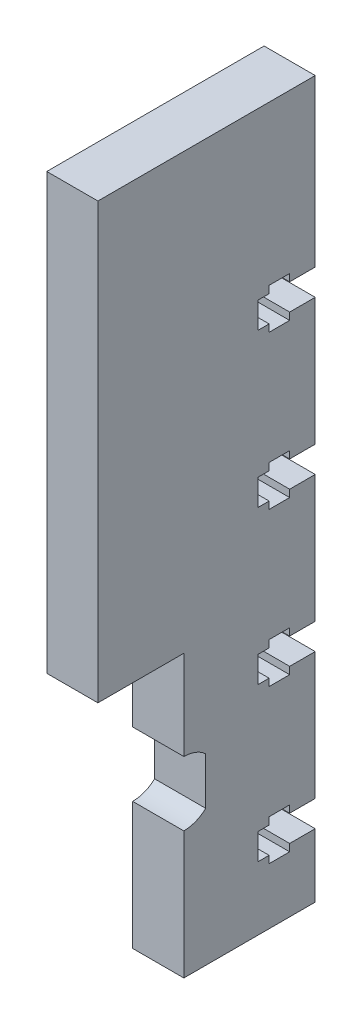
SolidWorks part; units mm, degrees
ref_plane "Front Plane" through (0, 0, 0) normal (0, 0, 1) x (1, 0, 0)
ref_plane "Top Plane" through (0, 0, 0) normal (0, 1, 0) x (1, 0, 0)
ref_plane "Right Plane" through (0, 0, 0) normal (1, 0, 0) x (0, 0, -1)
sketch "Sketch1" plane through (0, 0, 0) normal (0, 0, 1) x (1, 0, 0)
  line L0 (0, 0) -> (-42.672, 0) construction
  line L1 (-45.71, 0) -> (-33.01, 0)
  line L2 (-45.71, 0) -> (-45.71, 177.8)
  line L3 (-45.71, 177.8) -> (-33.01, 177.8)
  line L4 (-33.01, 0) -> (-33.01, 177.8)
  line L5 (-45.71, 45.5047) -> (-45.71, 33.7733) construction
  dimension "D1" = 12.7
  dimension "D2" = 177.8
extrude "Boss-Extrude1" add sketch "Sketch1" along normal blind 53.975
sketch "Sketch4" plane through (-33.01, 0, 0) normal (1, 0, 0) x (0, 0, -1)
  line L0 (-53.975, 69.85) -> (-32.6354, 69.85)
  line L1 (-53.975, 0) -> (-53.975, 177.8) construction
  line L2 (-32.6354, 69.85) -> (-53.975, 69.85) construction
  line L3 (-32.6354, 69.85) -> (-32.6354, 47.639)
  line L4 (-32.6354, 31.639) -> (-32.6354, 0)
  line L5 (-53.975, 0) -> (0, 0) construction
  line L6 (-32.6354, 0) -> (-53.975, 0)
  line L7 (-53.975, 0) -> (-53.975, 69.85)
  line L8 (-27.1954, 45.5047) -> (-27.1954, 33.7733)
  arc A0 (-27.1954, 45.5047) -> (-32.6354, 47.639) centre (-32.6354, 39.639) ccw
  arc A1 (-27.1954, 33.7733) -> (-32.6354, 31.639) centre (-32.6354, 39.639) cw
extrude "Cut-Extrude1" cut sketch "Sketch4" against normal through all
sketch "Sketch6" plane through (-33.01, 0, 0) normal (1, 0, 0) x (0, 0, -1)
  line L0 (-46.4072, 170.6201) -> (-48.8841, 162.9971)
  line L1 (0, 136.6) -> (-6.35, 136.6)
  line L2 (-6.35, 136.6) -> (-6.35, 138.4)
  line L3 (-6.35, 138.4) -> (-11.45, 138.4)
  line L4 (-11.45, 138.4) -> (-11.45, 136.6)
  line L5 (-11.45, 136.6) -> (-14.224, 136.6)
  line L6 (-14.224, 136.6) -> (-14.224, 130.1)
  line L7 (0, 136.6) -> (0, 130.1) construction
  line L8 (0, 133.35) -> (-39.8122, 133.35) construction
  line L9 (-11.45, 130.1) -> (-14.224, 130.1)
  line L10 (-11.45, 128.3) -> (-11.45, 130.1)
  line L11 (-6.35, 128.3) -> (-11.45, 128.3)
  line L12 (0, 130.1) -> (-6.35, 130.1)
  line L13 (-6.35, 130.1) -> (-6.35, 128.3)
  line L14 (0, 136.6) -> (0, 130.1)
  line L17 (0, 0) -> (0, 177.8) construction
  line L18 (0, 130.1) -> (6.35, 130.1) construction
  line L19 (-14.224, 98.5) -> (-14.224, 92)
  line L20 (-11.45, 90.2) -> (-11.45, 92)
  line L21 (-11.45, 92) -> (-14.224, 92)
  line L22 (-6.35, 90.2) -> (-11.45, 90.2)
  line L23 (-6.35, 92) -> (-6.35, 90.2)
  line L24 (0, 92) -> (-6.35, 92)
  line L25 (0, 98.5) -> (0, 92)
  line L26 (0, 98.5) -> (-6.35, 98.5)
  line L27 (-6.35, 98.5) -> (-6.35, 100.3)
  line L28 (-6.35, 100.3) -> (-11.45, 100.3)
  line L29 (-11.45, 100.3) -> (-11.45, 98.5)
  line L30 (-11.45, 98.5) -> (-14.224, 98.5)
  line L31 (-14.224, 60.4) -> (-14.224, 53.9)
  line L32 (-11.45, 52.1) -> (-11.45, 53.9)
  line L33 (-11.45, 53.9) -> (-14.224, 53.9)
  line L34 (-6.35, 52.1) -> (-11.45, 52.1)
  line L35 (-6.35, 53.9) -> (-6.35, 52.1)
  line L36 (0, 53.9) -> (-6.35, 53.9)
  line L37 (0, 60.4) -> (0, 53.9)
  line L38 (0, 60.4) -> (-6.35, 60.4)
  line L39 (-6.35, 60.4) -> (-6.35, 62.2)
  line L40 (-6.35, 62.2) -> (-11.45, 62.2)
  line L41 (-11.45, 62.2) -> (-11.45, 60.4)
  line L42 (-11.45, 60.4) -> (-14.224, 60.4)
  line L43 (-14.224, 22.3) -> (-14.224, 15.8)
  line L44 (-11.45, 14) -> (-11.45, 15.8)
  line L45 (-11.45, 15.8) -> (-14.224, 15.8)
  line L46 (-6.35, 14) -> (-11.45, 14)
  line L47 (-6.35, 15.8) -> (-6.35, 14)
  line L48 (0, 15.8) -> (-6.35, 15.8)
  line L49 (0, 22.3) -> (0, 15.8)
  line L50 (0, 22.3) -> (-6.35, 22.3)
  line L51 (-6.35, 22.3) -> (-6.35, 24.1)
  line L52 (-6.35, 24.1) -> (-11.45, 24.1)
  line L53 (-11.45, 24.1) -> (-11.45, 22.3)
  line L54 (-11.45, 22.3) -> (-14.224, 22.3)
  point P14 (-14.224, 133.35)
  dimension "D1" = 5.05
  dimension "D2" = 5.1
  dimension "D3" = 14.224
  dimension "D4" = 6.5
  dimension "D5" = 5.1
  dimension "D6" = 2.774
  dimension "D7" = 10.1
  dimension "D8" = 6.35
  dimension "D10" = 38.1
  dimension "D9" = 4
extrude "Cut-Extrude2" cut sketch "Sketch6" against normal through all contours L29 L30 L19 L21 L20 L22 L23 L24 L26 L27 L28 M9 | L13 L12 L1 L2 L3 L4 L5 L6 L9 L10 L11 M9 | L41 L42 L31 L33 L32 L34 L35 L36 L38 L39 L40 M9 | L53 L54 L43 L45 L44 L46 L47 L48 L50 L51 L52 M9
